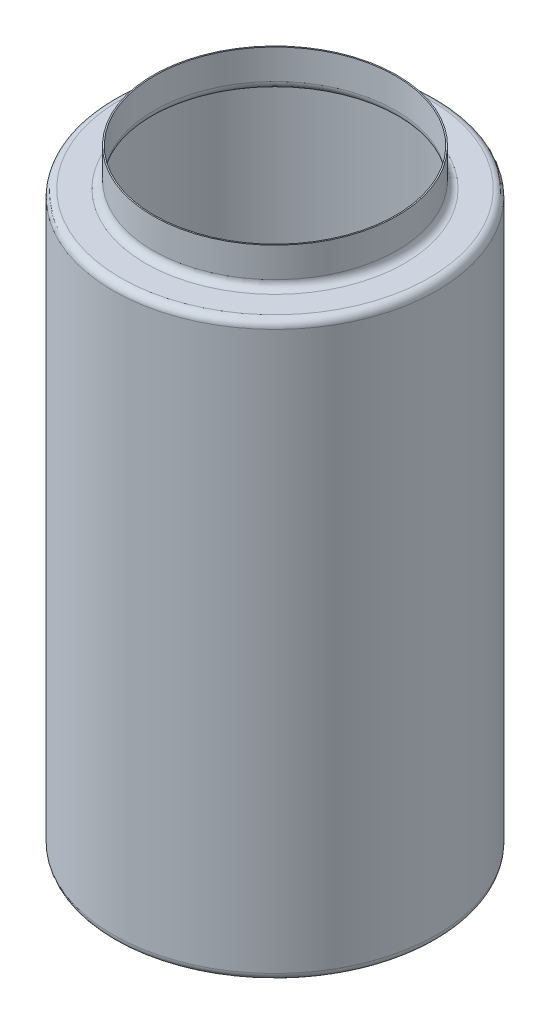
SolidWorks part; units mm, degrees
ref_plane "Plan de face" through (0, 0, 0) normal (0, 0, 1) x (1, 0, 0)
ref_plane "Plan de dessus" through (0, 0, 0) normal (0, 1, 0) x (1, 0, 0)
ref_plane "Plan de droite" through (0, 0, 0) normal (1, 0, 0) x (0, 0, -1)
sketch "Esquisse1" plane through (0, 0, 0) normal (0, 1, 0) x (1, 0, 0)
  circle A0 centre (0, 0) radius 65
  dimension "D1" = 130
extrude "Extrusion1" add sketch "Esquisse1" along normal blind 230
sketch "Esquisse2" plane through (0, 230, 0) normal (0, 1, 0) x (1, 0, 0)
  circle A0 centre (0, 0) radius 49
  dimension "D1" = 98
extrude "Extrusion2" add sketch "Esquisse2" along normal blind 15
fillet "Congé1" radius 3 3 edges at (0, 230, 65) (0, 0, 65) (0, 230, 49)
shell "Coque1" thickness 0.5
